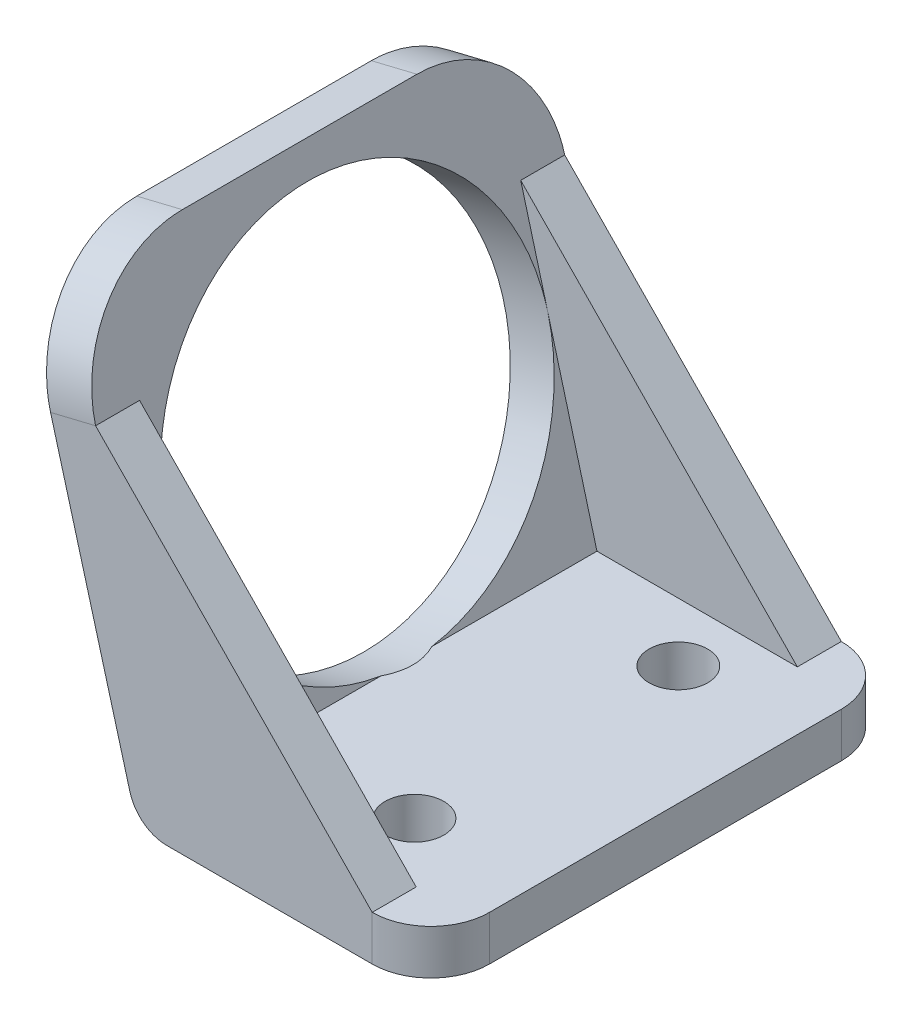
SolidWorks part; units mm, degrees
ref_plane "前视基准面" through (0, 0, 0) normal (0, 0, 1) x (1, 0, 0)
ref_plane "上视基准面" through (0, 0, 0) normal (0, 1, 0) x (1, 0, 0)
ref_plane "右视基准面" through (0, 0, 0) normal (1, 0, 0) x (0, 0, -1)
sketch "草图1" plane through (0, 0, 0) normal (0, 0, 1) x (1, 0, 0)
  line L0 (-7.504, 0) -> (2.496, 0)
  line L1 (-7.504, 0) -> (-11.5341, 14.668)
  line L2 (-9.9792, 15.0455) -> (-11.5341, 14.668)
  line L3 (2.496, 0) -> (2.496, 1.5272)
  line L5 (-9.9792, 15.0455) -> (-6.3387, 1.5272)
  line L6 (-6.3387, 1.5272) -> (2.496, 1.5272)
extrude "凸台-拉伸1" add sketch "草图1" along normal blind 16
sketch "草图2" plane through (-6.9773, -1.917, 0) normal (-0.9643, -0.2649, 0) x (0, 0, 1)
  line L3 (16, 9.5938) -> (0, 9.5938) construction
  line L4 (16, 17.1996) -> (16, 1.9881) construction
  circle A0 centre (8, 9.5938) radius 6.5
  dimension "D1" = 13
extrude "切除-拉伸1" cut sketch "草图2" against normal blind 22
fillet "圆角3" radius 2 2 edges at (2.496, 0.7636, 0) (2.496, 0.7636, 16)
fillet "圆角4" radius 1.3 1 edges at (-7.504, 0, 8)
fillet "圆角5" radius 4 2 edges at (-10.7566, 14.8568, 16) (-10.7566, 14.8568, 0)
sketch "草图14" plane through (0, 0, 0) normal (0, 0, -1) x (-1, 0, 0)
  line L0 (8.9387, 11.1819) -> (-0.496, 1.5272)
rib "筋1" sketch "草图14" sketch "草图14" thickness 1.5 extrusion direction parallel to sketch draft on no parameters "D1"=1.5
sketch "草图17" plane through (0, 0, 16) normal (0, 0, 1) x (1, 0, 0)
  line L0 (-8.9387, 11.1819) -> (0.496, 1.5272)
rib "筋2" sketch "草图17" sketch "草图17" thickness 1.5 extrusion direction parallel to sketch draft on no parameters "D1"=1.5
sketch "草图18" plane through (0, 1.5272, 0) normal (0, 1, 0) x (1, 0, 0)
  line L0 (2.496, -8) -> (-6.1196, -8) construction
  line L1 (2.496, -14) -> (2.496, -2) construction
  line L2 (-6.3387, -8.8668) -> (-6.3387, -7.1332) construction
  line L13 (-1.5629, -13.5) -> (-1.5629, -2.4761) construction
  circle A0 centre (-1.5629, -12.5) radius 1
  circle A1 centre (-1.5629, -3.5) radius 1
  ellipse E0 centre (-30.6542, -8) end of major axis (-55.1889, -8) minor radius 6.5 (-6.3387, -8.8668) -> (-6.3387, -7.1332) ccw construction
  dimension "D1" = 2
extrude "切除-拉伸2" cut sketch "草图18" against normal blind 10
